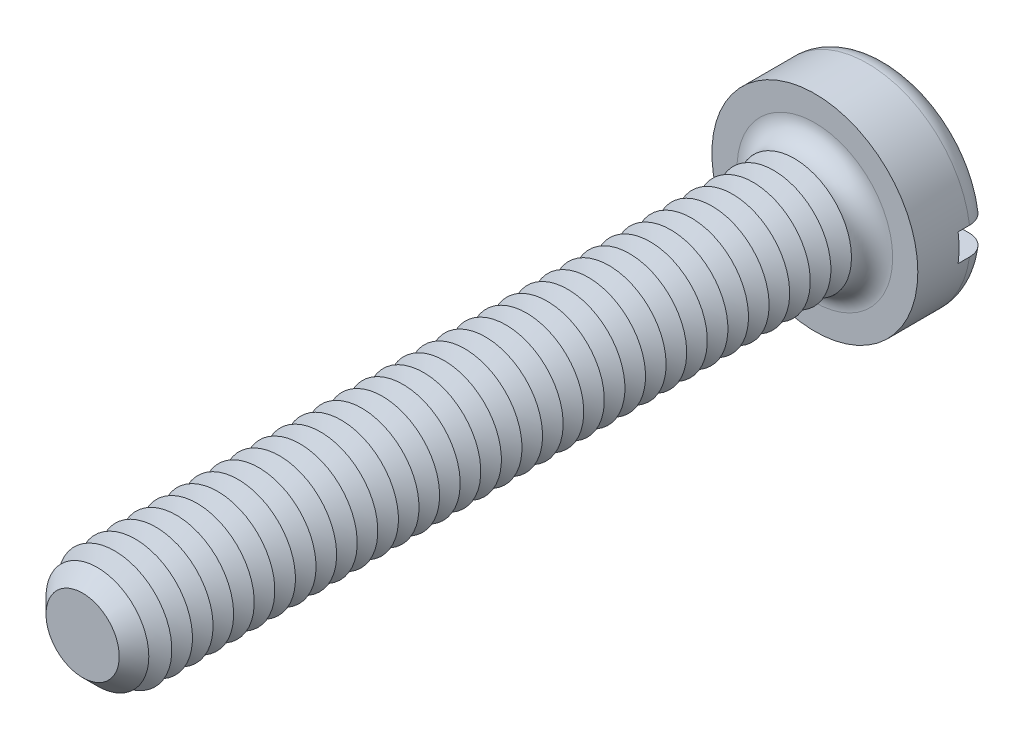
SolidWorks part; units mm, degrees
ref_plane "Front Plane" through (0, 0, 0) normal (0, 0, 1) x (1, 0, 0)
ref_plane "Top Plane" through (0, 0, 0) normal (0, 1, 0) x (1, 0, 0)
ref_plane "Right Plane" through (0, 0, 0) normal (1, 0, 0) x (0, 0, -1)
sketch "Sketch3" plane through (0, 0, 0) normal (0, 0, 1) x (1, 0, 0)
  circle A0 centre (0, 0) radius 2.25
  dimension "D1" = 4.5
extrude "Boss-Extrude2" add sketch "Sketch3" against normal blind 1.6
sketch "Sketch4" plane through (0, 0, 0) normal (0, 0, 1) x (1, 0, 0)
  circle A0 centre (0, 0) radius 1.25
  dimension "D1" = 2.5
extrude "Boss-Extrude3" add sketch "Sketch4" along normal blind 16
fillet "Fillet1" radius 0.45 2 edges at (2.25, 0, -1.6) (1.25, 0, 0)
chamfer "Chamfer1" distance 0.45 angle 45 1 edges at (1.25, 0, 16)
sketch "Sketch5" plane through (0, 0, 0) normal (1, 0, 0) x (0, 0, -1)
  line L0 (1.6944, 0) -> (-7.6738, 0) construction
sketch "Sketch6" plane through (0, 0, 0) normal (1, 0, 0) x (0, 0, -1)
  line L0 (-0.45, 1.25) -> (-0.675, 0.8603)
  line L1 (-0.675, 0.8603) -> (-0.9, 1.25)
  line L2 (-0.45, 1.25) -> (-15.55, 1.25) construction
  line L3 (-0.9, 1.25) -> (-0.45, 1.25)
  dimension "D1" = 0.45
revolve "Cut-Revolve1" cut sketch "Sketch6" angle 360 about L0
pattern_linear "LPattern1" count 34 spacing 0.45 along (0, 0, 1) of "Cut-Revolve1"
sketch "Sketch8" plane through (0, 0, -1.6) normal (0, 0, -1) x (-1, 0, 0)
  line L1 (2.25, -0.3) -> (-2.25, -0.3)
  line L2 (2.25, -0.3) -> (2.25, 0.3)
  line L3 (2.25, 0.3) -> (-2.25, 0.3)
  line L4 (-2.25, -0.3) -> (-2.25, 0.3)
  line L5 (2.25, -0.3) -> (-2.25, 0.3) construction
  line L6 (2.25, 0.3) -> (-2.25, -0.3) construction
  point P0 (0, 0)
  dimension "D1" = 4.5
  dimension "D2" = 0.6
extrude "Cut-Extrude1" cut sketch "Sketch8" against normal blind 0.7
